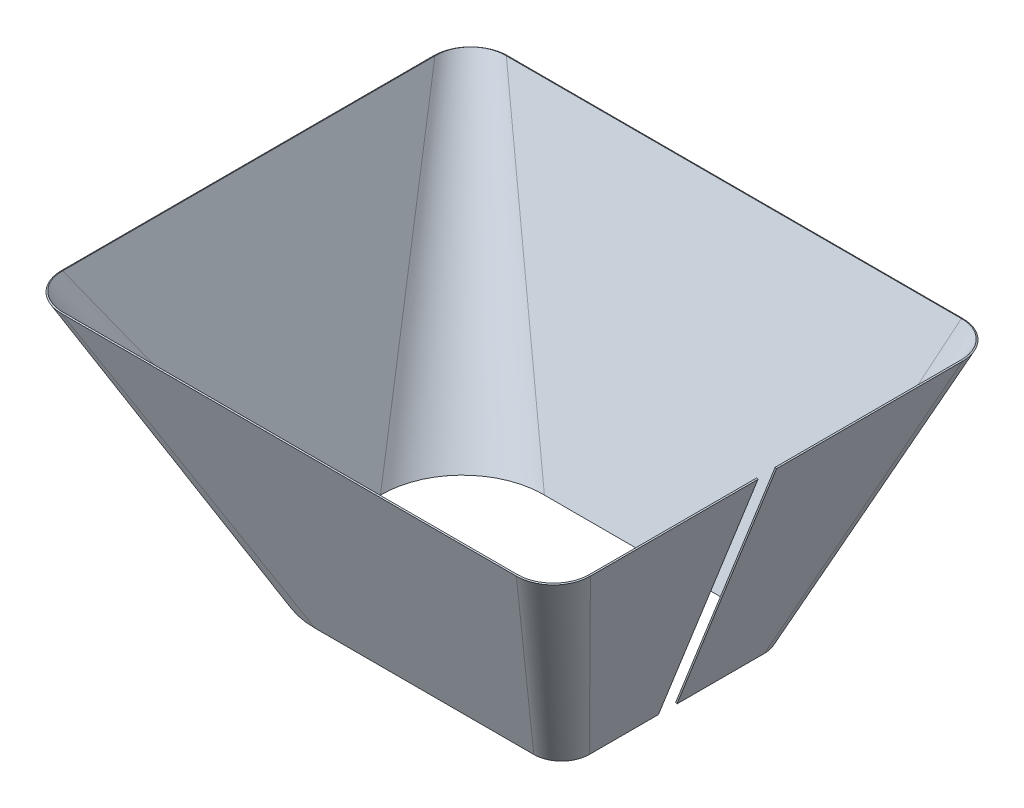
SolidWorks part; units mm, degrees
ref_plane "Front Plane" through (0, 0, 0) normal (0, 0, 1) x (1, 0, 0)
ref_plane "Top Plane" through (0, 0, 0) normal (0, 1, 0) x (1, 0, 0)
ref_plane "Right Plane" through (0, 0, 0) normal (1, 0, 0) x (0, 0, -1)
ref_plane "Plane1" through (0, 139.1824, 0) normal (0, 1, 0) x (-1, 0, 0)
sketch "Sketch2" plane through (0, 139.1824, 0) normal (0, 1, 0) x (-1, 0, 0)
  line L0 (-145.1951, -122.4868) -> (145.1951, 122.4868) construction
  line L1 (-124.8751, 122.4868) -> (124.8751, 122.4868)
  line L2 (-145.1951, 102.1668) -> (-145.1951, 10.16)
  line L3 (-124.8751, -122.4868) -> (124.8751, -122.4868)
  line L4 (145.1951, 102.1668) -> (145.1951, -102.1668)
  line L7 (-145.1951, 0) -> (-145.1951, -102.1668)
  arc A0 (-124.8751, 122.4868) -> (-145.1951, 102.1668) centre (-124.8751, 102.1668) ccw
  arc A1 (124.8751, 122.4868) -> (145.1951, 102.1668) centre (124.8751, 102.1668) cw
  arc A2 (124.8751, -122.4868) -> (145.1951, -102.1668) centre (124.8751, -102.1668) ccw
  arc A3 (-145.1951, -102.1668) -> (-124.8751, -122.4868) centre (-124.8751, -102.1668) ccw
  dimension "D1" = 10.16
  dimension "D2" = 20.32
sheet metal parameters "Sheet-Metal1" thickness 0.7874 parameters "D1"=6.35
sketch "Sketch4" plane through (0, 0, 0) normal (0, 1, 0) x (1, 0, 0)
  line L0 (-90.5275, -63.3137) -> (90.5275, 63.3137) construction
  line L1 (-44.8075, 63.3137) -> (75.2875, 63.3137)
  line L2 (-90.5275, 17.5937) -> (-90.5275, -17.5937)
  line L3 (-44.8075, -63.3137) -> (75.2875, -63.3137)
  line L4 (90.5275, 48.0737) -> (90.5275, 0)
  line L7 (90.5275, -10.16) -> (90.5275, -48.0737)
  arc A0 (-44.8075, 63.3137) -> (-90.5275, 17.5937) centre (-44.8075, 17.5937) ccw
  arc A1 (-90.5275, -17.5937) -> (-44.8075, -63.3137) centre (-44.8075, -17.5937) ccw
  arc A2 (75.2875, 63.3137) -> (90.5275, 48.0737) centre (75.2875, 48.0737) cw
  arc A3 (75.2875, -63.3137) -> (90.5275, -48.0737) centre (75.2875, -48.0737) ccw
  dimension "D1" = 45.72
  dimension "D2" = 15.24
lofted bend "Lofted Bends2"
other "Freeform Bend2" parameters "D1"=1000, "D4"=57.296, "D5"=1
other "Freeform Bend3" parameters "D1"=1000, "D4"=57.296, "D5"=2
other "Freeform Bend4" parameters "D1"=1000, "D4"=57.296, "D5"=3
other "Freeform Bend5" parameters "D1"=1000, "D4"=57.296, "D5"=4, "D12"=0.7874
flat pattern "Flat-Pattern1"
sketch "Bend-Lines1" plane through (0, -22.7971, 53.6215) normal (0, -0.3913, 0.9203) x (1, 0, 0)
  line L0 (124.8751, 176.0108) -> (75.2875, 24.7719) construction
  line L1 (126.8945, 175.9699) -> (76.7869, 24.7411) construction
  line L2 (128.8915, 175.8448) -> (78.2752, 24.6491) construction
  line L3 (130.8521, 175.636) -> (79.7355, 24.4921) construction
  line L4 (132.7798, 175.3424) -> (81.172, 24.2744) construction
  line L5 (134.6765, 174.9637) -> (82.5856, 23.9934) construction
  line L6 (136.5431, 174.4998) -> (83.9763, 23.6474) construction
  line L7 (138.3796, 173.9512) -> (85.3447, 23.2388) construction
  line L8 (140.185, 173.3179) -> (86.6899, 22.767) construction
  line L9 (141.958, 172.599) -> (88.0126, 22.2359) construction
  line L10 (143.6986, 171.7975) -> (89.308, 21.6347) construction
  line L11 (145.4087, 170.9203) -> (90.5802, 20.9762) construction
  line L12 (147.0832, 169.9535) -> (91.8296, 20.2614) construction
  line L13 (148.725, 168.9017) -> (93.0526, 19.4775) construction
  line L14 (150.3388, 167.7704) -> (94.256, 18.6375) construction
  line L15 (151.9288, 166.5584) -> (95.4386, 17.7293) construction
  line L16 (153.5424, 165.2139) -> (96.6539, 16.7212) construction
  line L49 (-124.8751, 176.0108) -> (-44.8075, 24.7719) construction
  line L50 (-126.2247, 175.9893) -> (-47.8939, 24.7227) construction
  line L51 (-127.5695, 175.933) -> (-50.9574, 24.6035) construction
  line L52 (-128.8981, 175.8411) -> (-53.9747, 24.3845) construction
  line L53 (-130.2084, 175.706) -> (-56.9541, 24.0742) construction
  line L54 (-131.5011, 175.526) -> (-59.9022, 23.6801) construction
  line L55 (-132.7828, 175.3134) -> (-62.8111, 23.1826) construction
  line L56 (-134.0466, 175.053) -> (-65.6866, 22.5913) construction
  line L57 (-135.2945, 174.7482) -> (-68.5321, 21.9142) construction
  line L58 (-136.5324, 174.4133) -> (-71.3387, 21.1314) construction
  line L59 (-137.7526, 174.0316) -> (-74.1122, 20.2584) construction
  line L60 (-138.9568, 173.608) -> (-76.8506, 19.2937) construction
  line L61 (-140.1427, 173.1388) -> (-79.5509, 18.2332) construction
  line L62 (-141.315, 172.637) -> (-82.2133, 17.0813) construction
  line L63 (-142.4684, 172.0912) -> (-84.8329, 15.8291) construction
  line L64 (-143.6029, 171.5027) -> (-87.4151, 14.494) construction
  line L65 (-144.7186, 170.8726) -> (-89.9574, 13.073) construction
  line L66 (-145.8155, 170.2021) -> (-92.4514, 11.5433) construction
  line L67 (-146.894, 169.4921) -> (-94.9074, 9.936) construction
  line L68 (-147.9545, 168.7434) -> (-97.3228, 8.2416) construction
  line L69 (-148.9978, 167.9568) -> (-99.694, 6.445) construction
  line L70 (-150.0248, 167.1324) -> (-102.0315, 4.5734) construction
  line L71 (-151.0368, 166.2701) -> (-104.3316, 2.6045) construction
  line L72 (-152.0357, 165.369) -> (-106.6025, 0.5512) construction
  line L73 (-153.0521, 164.3998) -> (-108.8775, -1.6168) construction
  line L98 (-299.0631, 21.4556) -> (-134.0214, -26.2326) construction
  line L99 (-300.0133, 20.497) -> (-136.1946, -28.4248) construction
  line L100 (-300.9372, 19.5182) -> (-138.3053, -30.6485) construction
  line L101 (-301.826, 18.5263) -> (-140.3167, -32.9081) construction
  line L102 (-302.6727, 17.5172) -> (-142.24, -35.2046) construction
  line L103 (-303.4767, 16.4892) -> (-144.0847, -37.5379) construction
  line L104 (-304.2509, 15.4458) -> (-145.8315, -39.9164) construction
  line L105 (-304.9798, 14.381) -> (-147.4909, -42.3379) construction
  line L106 (-305.667, 13.296) -> (-149.0706, -44.8) construction
  line L107 (-306.3268, 12.196) -> (-150.55, -47.31) construction
  line L108 (-306.9418, 11.075) -> (-151.9438, -49.8618) construction
  line L109 (-307.5163, 9.9351) -> (-153.2495, -52.4551) construction
  line L110 (-308.0462, 8.7751) -> (-154.4615, -55.0909) construction
  line L111 (-308.5439, 7.6008) -> (-155.5829, -57.7663) construction
  line L112 (-308.9976, 6.4081) -> (-156.6035, -60.4844) construction
  line L113 (-309.4079, 5.1977) -> (-157.5393, -63.2367) construction
  line L114 (-309.7752, 3.9704) -> (-158.386, -66.0238) construction
  line L115 (-310.1003, 2.7267) -> (-159.1208, -68.8553) construction
  line L116 (-310.3838, 1.4672) -> (-159.773, -71.7173) construction
  line L117 (-310.6265, 0.192) -> (-160.3335, -74.614) construction
  line L118 (-310.829, -1.0988) -> (-160.7882, -77.5538) construction
  line L119 (-310.9922, -2.4058) -> (-161.164, -80.5247) construction
  line L120 (-311.1167, -3.7298) -> (-161.4414, -83.5396) construction
  line L121 (-311.2029, -5.0725) -> (-161.635, -86.595) construction
  line L122 (-311.2522, -6.4761) -> (-161.7467, -89.7356) construction
  line L147 (-316.553, -256.17) -> (-164.2957, -209.8035) construction
  line L148 (-316.5549, -258.1899) -> (-164.2967, -211.3033) construction
  line L149 (-316.4722, -260.1891) -> (-164.2363, -212.7932) construction
  line L150 (-316.3052, -262.1537) -> (-164.1103, -214.2564) construction
  line L151 (-316.0525, -264.0872) -> (-163.9232, -215.6973) construction
  line L152 (-315.7141, -265.9915) -> (-163.6722, -217.1165) construction
  line L153 (-315.29, -267.8675) -> (-163.3559, -218.5142) construction
  line L154 (-314.7804, -269.7152) -> (-162.9764, -219.891) construction
  line L155 (-314.1856, -271.5337) -> (-162.5332, -221.2459) construction
  line L156 (-313.5045, -273.3215) -> (-162.0304, -222.5796) construction
  line L157 (-312.7401, -275.0788) -> (-161.4568, -223.8874) construction
  line L158 (-311.8994, -276.8071) -> (-160.8254, -225.1733) construction
  line L159 (-310.9684, -278.5017) -> (-160.1372, -226.4376) construction
  line L160 (-309.9516, -280.1655) -> (-159.3796, -227.677) construction
  line L161 (-308.8548, -281.803) -> (-158.5653, -228.8979) construction
  line L162 (-307.6769, -283.4183) -> (-157.6824, -230.0995) construction
  line L163 (-306.3669, -285.06) -> (-156.7003, -231.336) construction
other "Flatten-<Freeform Bend2>1"
other "Flatten-<Freeform Bend3>1"
other "Flatten-<Freeform Bend4>1"
other "Flatten-<Freeform Bend5>1"
